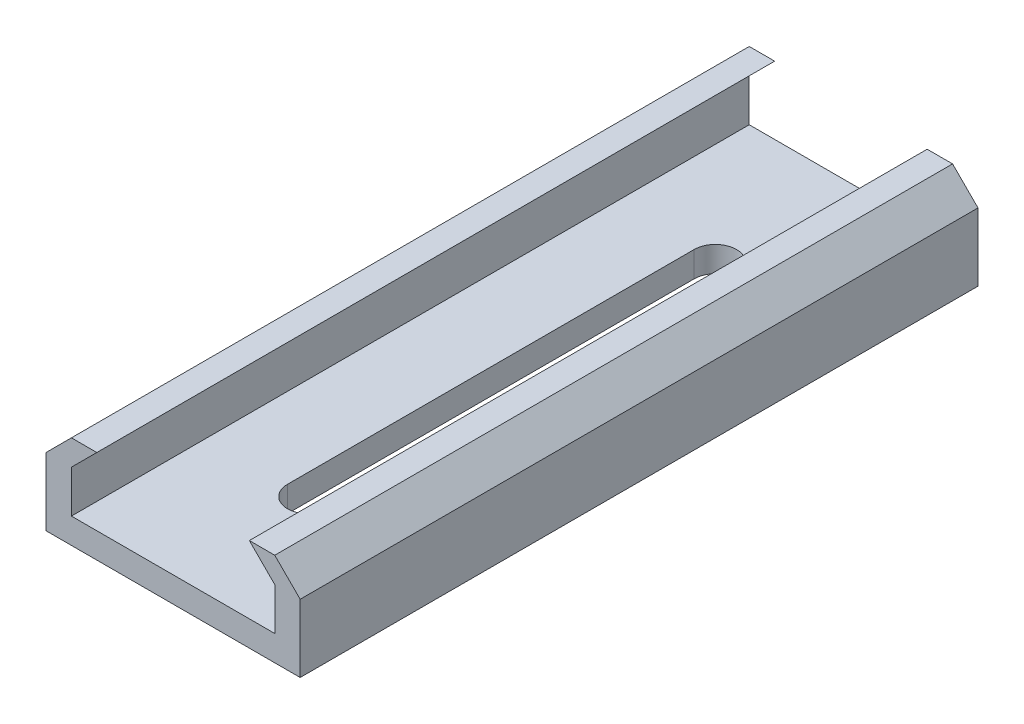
SolidWorks part; units mm, degrees
ref_plane "Front" through (0, 0, 0) normal (0, 0, 1) x (1, 0, 0)
ref_plane "Top" through (0, 0, 0) normal (0, 1, 0) x (1, 0, 0)
ref_plane "Right" through (0, 0, 0) normal (1, 0, 0) x (0, 0, -1)
sketch "Sketch1" plane through (0, 0, 0) normal (0, 0, 1) x (1, 0, 0)
  line L3 (-28.575, 25.4) -> (28.575, 25.4) construction
  line L6 (-47.625, 15.875) -> (-38.1, 25.4)
  line L7 (-47.625, -9.525) -> (-47.625, 15.875)
  line L8 (-47.625, -9.525) -> (47.625, -9.525)
  line L9 (47.625, -9.525) -> (47.625, 15.875)
  line L10 (38.1, 25.4) -> (47.625, 15.875)
  line L11 (-38.1, 25.4) -> (-28.575, 25.4)
  line L12 (28.575, 25.4) -> (38.1, 25.4)
  line L23 (38.1, 15.875) -> (28.575, 25.4)
  line L24 (38.1, 0) -> (38.1, 15.875)
  line L25 (-38.1, 0) -> (38.1, 0)
  line L26 (-38.1, 15.875) -> (-38.1, 0)
  line L27 (-28.575, 25.4) -> (-38.1, 15.875)
  point P0 (0, 0)
  dimension "D1" = 76.2
  dimension "D2" = 9.525
  dimension "D3" = 25.4
  dimension "D5" = 9.525
  dimension "D4" = 9.525
  dimension "D6" = 9.525
  dimension "D7" = 57.15
  dimension "D8" = 45
  dimension "D9" = 45
extrude "Base-Extrude" add sketch "Sketch1" against normal blind 254
sketch "Sketch2" plane through (9.0144, -9.525, -72.3299) normal (0, -1, 0) x (0, 0, 1)
  line L0 (-130.8701, 9.0144) -> (21.5299, 9.0144) construction
  line L1 (-54.6701, 16.9519) -> (-54.6701, 1.0769) construction
  line L2 (-130.8701, 16.9519) -> (21.5299, 16.9519)
  line L3 (21.5299, 1.0769) -> (-130.8701, 1.0769)
  line L4 (72.3299, 56.6394) -> (72.3299, -38.6106) construction
  line L5 (22.3299, 9.0144) -> (122.3299, 9.0144) construction
  arc A0 (21.5299, 16.9519) -> (21.5299, 1.0769) centre (21.5299, 9.0144) cw
  arc A1 (-130.8701, 16.9519) -> (-130.8701, 1.0769) centre (-130.8701, 9.0144) ccw
  point P12 (-54.6701, 9.0144)
  dimension "D1" = 50.8
  dimension "Slot width" = 15.875
  dimension "Slot length" = 152.4
extrude "Slot straight1" cut sketch "Sketch2" against normal through all
sketch "Sketch3" plane through (0, -9.525, 0) normal (0, -1, 0) x (1, 0, 0)
  line L0 (0, 0) -> (0, -254) construction
  line L1 (-47.625, -254) -> (47.625, -254) construction
  circle A0 centre (-25.4, -203.2) radius 7.874
  circle A1 centre (25.4, -203.2) radius 7.874
  dimension "D1" = 15.748
  dimension "D2" = 50.8
  dimension "D3" = 50.8
extrude "Boss-Extrude1" add sketch "Sketch3" along normal blind 9.525
